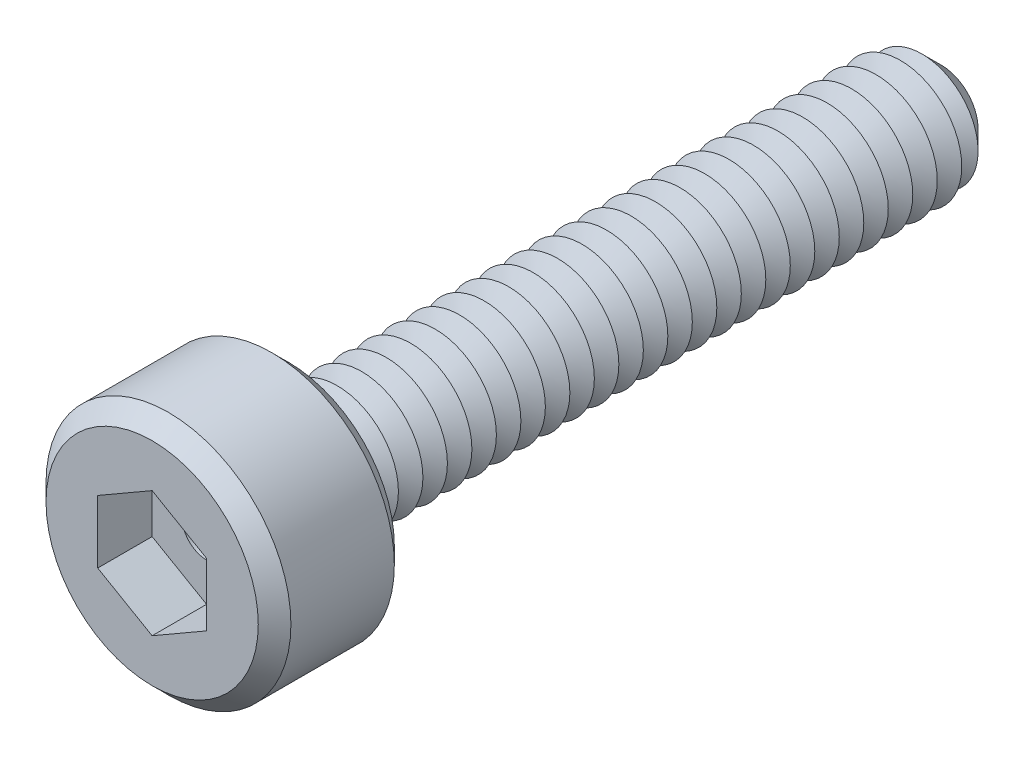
SolidWorks part; units mm, degrees
ref_plane "Front Plane" through (0, 0, 0) normal (0, 0, 1) x (1, 0, 0)
ref_plane "Top Plane" through (0, 0, 0) normal (0, 1, 0) x (1, 0, 0)
ref_plane "Right Plane" through (0, 0, 0) normal (1, 0, 0) x (0, 0, -1)
sketch "Sketch1" plane through (0, 0, 0) normal (0, 0, 1) x (1, 0, 0)
  circle A0 centre (0, 0) radius 2.25
  dimension "D1" = 4.5
extrude "Boss-Extrude1" add sketch "Sketch1" along normal blind 2.5
sketch "Sketch2" plane through (0, 0, 0) normal (0, 0, -1) x (-1, 0, 0)
  circle A0 centre (0, 0) radius 1.125
  dimension "D1" = 2.25
extrude "Boss-Extrude2" add sketch "Sketch2" along normal blind 12
chamfer "Chamfer1" distance 0.45 angle 45 1 edges at (-1.125, 0, -12)
sketch "Sketch3" plane through (0, 0, 0) normal (1, 0, 0) x (0, 0, -1)
  line L0 (-2.5121, 0) -> (4.5776, 0) construction
sketch "Sketch4" plane through (0, 0, 0) normal (1, 0, 0) x (0, 0, -1)
  line L0 (0, 1.125) -> (0.225, 0.7353)
  line L1 (0.225, 0.7353) -> (0.45, 1.125)
  line L2 (11.55, 1.125) -> (0, 1.125) construction
  line L3 (0.45, 1.125) -> (0, 1.125)
  dimension "D1" = 0.45
revolve "Cut-Revolve1" cut sketch "Sketch4" angle 360 about L0
pattern_linear "LPattern1" count 26 spacing 0.45 along (0, 0, -1) of "Cut-Revolve1"
sketch "Sketch5" plane through (0, 0, 2.5) normal (0, 0, 1) x (1, 0, 0)
  line L1 (0, 1.1547) -> (-1, 0.5774)
  line L2 (-1, 0.5774) -> (-1, -0.5774)
  line L3 (-1, -0.5774) -> (0, -1.1547)
  line L4 (0, -1.1547) -> (1, -0.5774)
  line L5 (1, -0.5774) -> (1, 0.5774)
  line L6 (1, 0.5774) -> (0, 1.1547)
  circle A0 centre (0, 0) radius 1 construction
  dimension "D1" = 2
extrude "Cut-Extrude1" cut sketch "Sketch5" against normal blind 1
sketch "Sketch6" plane through (0, 0, 1.5) normal (0, 0, 1) x (1, 0, 0)
  circle A0 centre (0, 0) radius 0.45
  dimension "D1" = 0.9
extrude "Cut-Extrude2" cut sketch "Sketch6" against normal up to surface (13.5 mm away)
chamfer "Chamfer2" distance 0.3 angle 45 2 edges at (2.25, 0, 0) (2.25, 0, 2.5)
